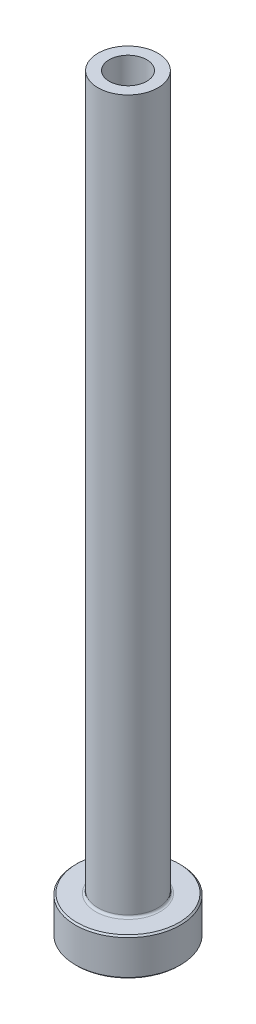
SolidWorks part; units mm, degrees
ref_plane "Front Plane" through (0, 0, 0) normal (0, 0, 1) x (1, 0, 0)
ref_plane "Top Plane" through (0, 0, 0) normal (0, 1, 0) x (1, 0, 0)
ref_plane "Right Plane" through (0, 0, 0) normal (1, 0, 0) x (0, 0, -1)
sketch "Sketch1" plane through (0, 0, 0) normal (0, 0, 1) x (1, 0, 0)
  line L0 (-2.5, 100) -> (-4, 100)
  line L1 (-4, 100) -> (-4, 5)
  line L2 (-4, 5) -> (-7, 5)
  line L3 (-7, 5) -> (-7, 0)
  line L4 (7.7, 0) -> (-7.7, 0) construction
  line L5 (-7, 0) -> (-2.75, 0)
  line L6 (-2.5, 55) -> (-2.5, 100)
  line L7 (0, 92.1877) -> (0, -15.5353) construction
  line L8 (0, -7.7) -> (0, 7.7) construction
  line L9 (-2.5, 55) -> (-2.75, 43)
  line L10 (-2.75, 43) -> (-2.75, 0)
  dimension "D1" = 0.25
  dimension "ID" = 5
  dimension "OD" = 8
  dimension "L" = 100
  dimension "H" = 14
  dimension "T" = 5
  dimension "N" = 45
  dimension "D2" = 12
revolve "Revolve1" add sketch "Sketch1" angle 360 about L7
fillet "Fillet1" radius 0.3 1 edges at (0, 5, 4)
chamfer "Chamfer1" distance 0.2 angle 45 2 edges at (0, 5, 7) (0, 0, 7)
chamfer "Chamfer3" distance 0.5 angle 45 1 edges at (0, 0, 2.75)
